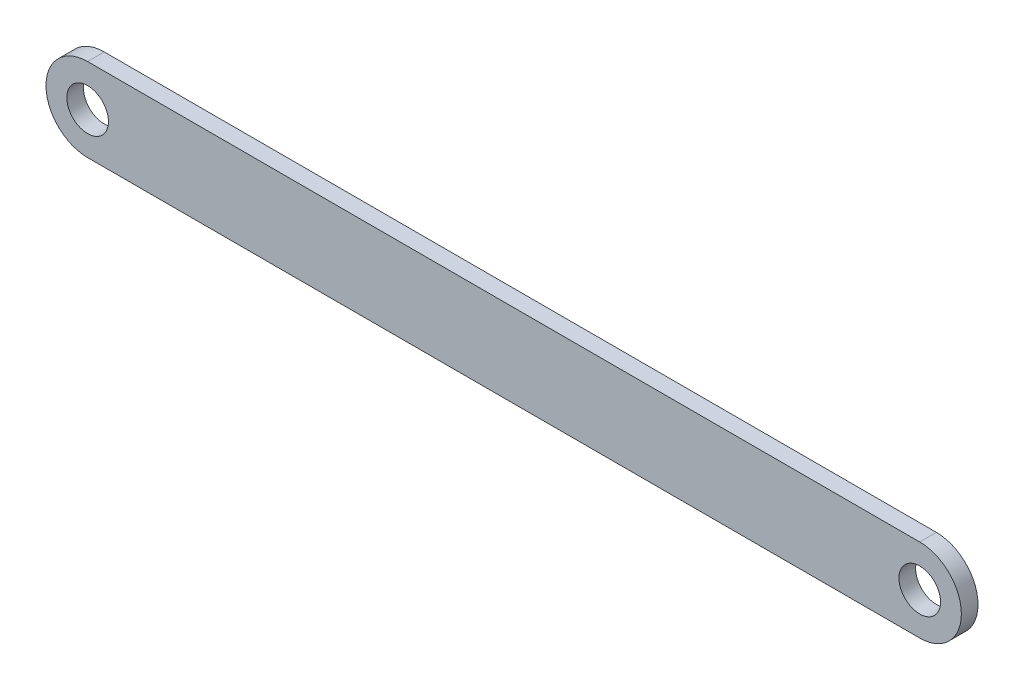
SolidWorks part; units mm, degrees
ref_plane "Front Plane" through (0, 0, 0) normal (0, 0, 1) x (1, 0, 0)
ref_plane "Top Plane" through (0, 0, 0) normal (0, 1, 0) x (1, 0, 0)
ref_plane "Right Plane" through (0, 0, 0) normal (1, 0, 0) x (0, 0, -1)
sketch "Sketch1" plane through (0, 0, 0) normal (0, 0, 1) x (1, 0, 0)
  line L0 (-50, 0) -> (50, 0) construction
  line L1 (-50, 5) -> (50, 5)
  line L2 (-50, -5) -> (50, -5)
  arc A0 (-50, 5) -> (-50, -5) centre (-50, 0) ccw
  arc A1 (50, -5) -> (50, 5) centre (50, 0) ccw
  circle A2 centre (-50, 0) radius 2.5
  circle A3 centre (50, 0) radius 2.5
  point P2 (0, 0)
  dimension "D3" = 5
  dimension "D4" = 5
  dimension "D1" = 100
  dimension "D2" = 10
extrude "Boss-Extrude1" add sketch "Sketch1" along normal mid plane 2
